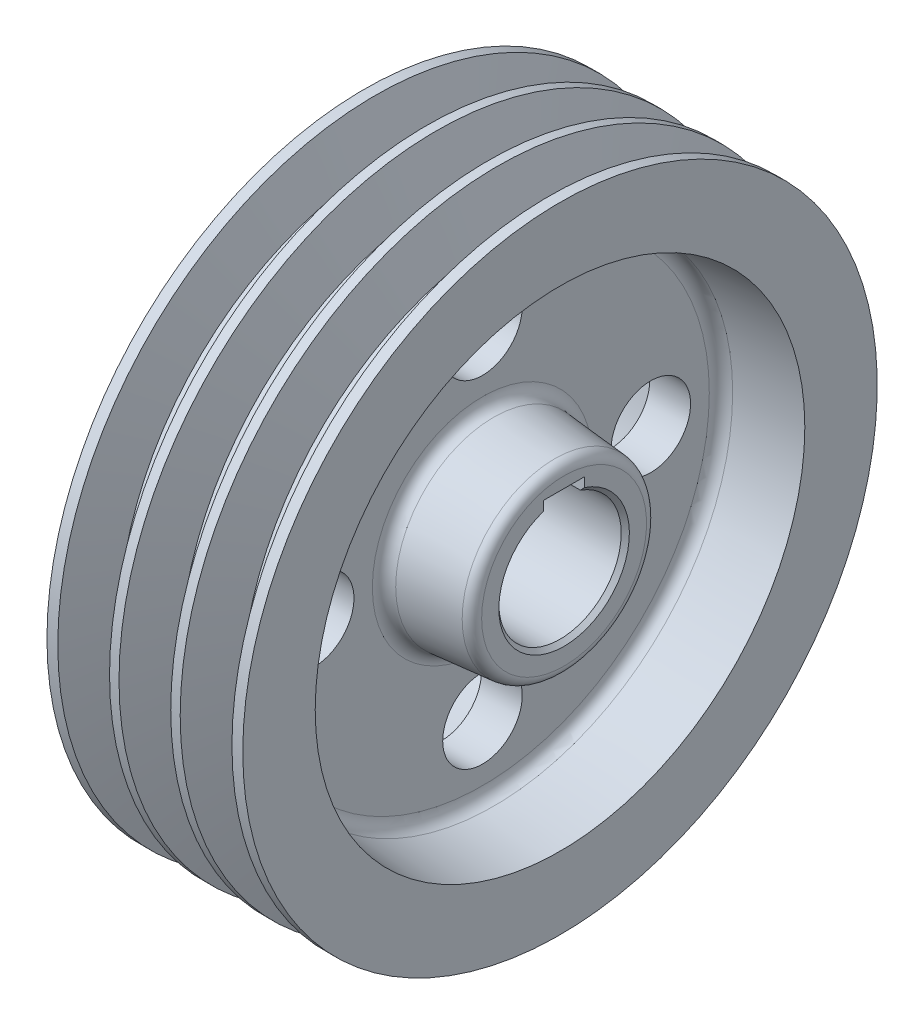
SolidWorks part; units mm, degrees
ref_plane "前视基准面" through (0, 0, 0) normal (0, 0, 1) x (1, 0, 0)
ref_plane "上视基准面" through (0, 0, 0) normal (0, 1, 0) x (1, 0, 0)
ref_plane "右视基准面" through (0, 0, 0) normal (1, 0, 0) x (0, 0, -1)
sketch "草图1" plane through (0, 0, 0) normal (0, 0, 1) x (1, 0, 0)
  line L0 (0, 0) -> (64.8368, 0) construction
  line L1 (-1, 15) -> (-1, 22.5)
  line L2 (0, 77.75) -> (48, 77.75)
  line L3 (48, 77.75) -> (48, 60)
  line L4 (-1, 22.5) -> (-30, 22.5) construction
  line L5 (19, 24.2498) -> (19, 58.3377)
  line L6 (49, 15) -> (-1, 15)
  line L7 (2.6592, 77.75) -> (6.1599, 66.3) construction
  line L8 (6.1599, 66.3) -> (11.8401, 66.3) construction
  line L9 (11.8401, 66.3) -> (15.3408, 77.75) construction
  line L10 (0, 75) -> (48, 75) construction
  line L11 (9, 66.3) -> (9, 15) construction
  line L12 (44, 60) -> (0, 60) construction
  line L13 (48, 60) -> (79, 60) construction
  line L14 (29, 58.3377) -> (29, 24.2498)
  line L15 (5, 22.5) -> (49, 22.5) construction
  line L16 (24, 15) -> (24, 77.75) construction
  line L17 (49, 22.5) -> (49, 15)
  line L18 (0, 60) -> (0, 77.75)
  line L19 (19, 51) -> (29, 51) construction
  line L20 (19, 31.5) -> (29, 31.5) construction
  line L21 (48, 60) -> (48, 51) construction
  line L22 (48, 51) -> (29, 51) construction
  line L23 (29, 31.5) -> (49, 31.5) construction
  line L24 (49, 31.5) -> (49, 22.5) construction
  line L25 (29, 58.3377) -> (48, 60)
  line L26 (19, 58.3377) -> (0, 60)
  line L27 (19, 24.2498) -> (-1, 22.5)
  line L28 (29, 24.2498) -> (49, 22.5)
  point P17 (3.5, 75)
  point P18 (14.5, 75)
  dimension "d2" = 120
  dimension "L" = 50
  dimension "B" = 48
  dimension "d" = 30
  dimension "d1" = 45
  dimension "D3" = 5
  dimension "D4" = 5
  dimension "dd" = 150
  dimension "f" = 9
  dimension "槽轮角" = 34
  dimension "bd" = 11
  dimension "hf" = 8.7
  dimension "ha" = 2.75
  dimension "da" = 155.5
  dimension "S" = 10
  dimension "S2" = 9
revolve "旋转1" add sketch "草图1" angle 360 about L0
sketch "草图2" plane through (0, 0, 0) normal (0, 0, 1) x (1, 0, 0)
  line L0 (11.8401, 66.3) -> (15.3408, 77.75) construction
  line L1 (6.1599, 66.3) -> (11.8401, 66.3) construction
  line L2 (2.6592, 77.75) -> (6.1599, 66.3) construction
  line L3 (11.8401, 66.3) -> (15.3408, 77.75)
  line L4 (6.1599, 66.3) -> (11.8401, 66.3)
  line L5 (2.6592, 77.75) -> (6.1599, 66.3)
  line L6 (2.6592, 77.75) -> (15.3408, 77.75)
  line L7 (0, 0) -> (123, 0) construction
revolve "切除-旋转1" cut sketch "草图2" angle 360 about L7
pattern_linear "轮槽数" count 3 spacing 15 along (1, 0, 0) of "切除-旋转1"
chamfer "倒角1" distance 1 2 edges at (-1, 0, 15) (49, 0, 15)
sketch "草图4" plane through (-1, 0, 0) normal (-1, 0, 0) x (0, 0, 1)
  line L1 (-5, 14.1421) -> (5, 14.1421)
  line L2 (-5, 14.1421) -> (-5, 17.5)
  line L3 (-5, 17.5) -> (5, 17.5)
  line L4 (5, 14.1421) -> (5, 17.5)
  circle A0 centre (0, 0) radius 15 construction
  point P6 (2.5, 17.5)
  dimension "键槽高度" = 17.5
  dimension "键槽宽度" = 10
  dimension "t1" = 2.5
extrude "切除-拉伸1" cut sketch "草图4" against normal through all
fillet "圆角1" radius 3 4 edges at (29, 0, 58.3377) (19, 0, 24.2498) (19, 0, 58.3377) (29, 0, 24.2498)
fillet "圆角2" radius 2.5 2 edges at (49, 0, 22.5) (-1, 0, 22.5)
sketch "草图5" plane through (0, 0, 0) normal (1, 0, 0) x (0, 0, -1)
  line L0 (0, 66.3) -> (0, 15) construction
  circle A0 centre (0, 41.25) radius 9.75
extrude "切除-拉伸2" cut sketch "草图5" along normal through all
pattern_circular "圆孔个数" count 4 over 360 about axis through (0, 0, 0) along (1, 0, 0) of "切除-拉伸2"
equation "\"B@草图1\" =  ( \"z@轮槽数\" - 1 )  * \"e@轮槽数\" +2 *  \"f@草图1\""
equation "\"键槽高度@草图4\" = \"d@草图1\" / 2 + \"t1@草图4\""
